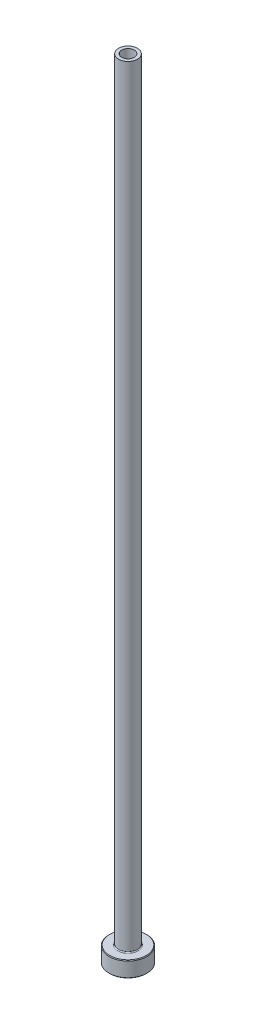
SolidWorks part; units mm, degrees
ref_plane "Front Plane" through (0, 0, 0) normal (0, 0, 1) x (1, 0, 0)
ref_plane "Top Plane" through (0, 0, 0) normal (0, 1, 0) x (1, 0, 0)
ref_plane "Right Plane" through (0, 0, 0) normal (1, 0, 0) x (0, 0, -1)
sketch "Sketch1" plane through (0, 0, 0) normal (0, 0, 1) x (1, 0, 0)
  line L0 (-2, 250) -> (-3, 250)
  line L1 (-3, 250) -> (-3, 5)
  line L2 (-3, 5) -> (-6, 5)
  line L3 (-6, 5) -> (-6, 0)
  line L4 (6.6, 0) -> (-6.6, 0) construction
  line L5 (-6, 0) -> (-2.25, 0)
  line L6 (-2, 205) -> (-2, 250)
  line L7 (0, 92.1877) -> (0, -15.5353) construction
  line L8 (0, -6.6) -> (0, 6.6) construction
  line L9 (-2, 205) -> (-2.25, 193)
  line L10 (-2.25, 193) -> (-2.25, 0)
  dimension "D1" = 0.25
  dimension "ID" = 4
  dimension "OD" = 6
  dimension "L" = 250
  dimension "H" = 12
  dimension "T" = 5
  dimension "N" = 45
  dimension "D2" = 12
revolve "Revolve1" add sketch "Sketch1" angle 360 about L7
fillet "Fillet1" radius 0.3 1 edges at (0, 5, 3)
chamfer "Chamfer1" distance 0.2 angle 45 2 edges at (0, 5, 6) (0, 0, 6)
chamfer "Chamfer3" distance 0.5 angle 45 1 edges at (0, 0, 2.25)
